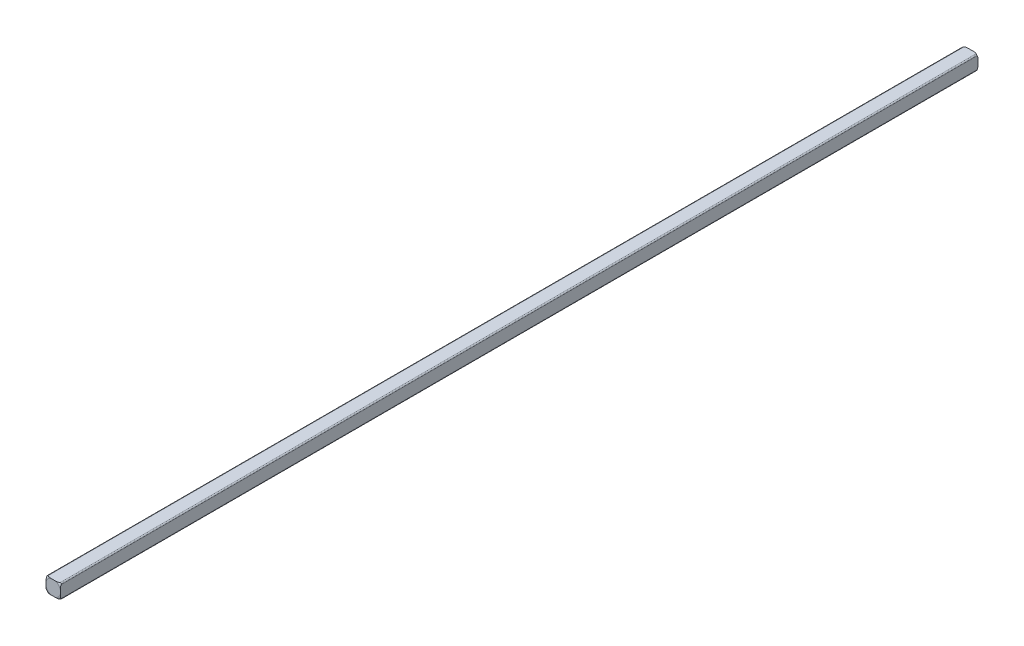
SolidWorks part; units mm, degrees
ref_plane "Front" through (0, 0, 0) normal (0, 0, 1) x (1, 0, 0)
ref_plane "Top" through (0, 0, 0) normal (0, 1, 0) x (1, 0, 0)
ref_plane "Right" through (0, 0, 0) normal (1, 0, 0) x (0, 0, -1)
imported_body "Imported3"
fillet "Fillet1" radius 0.254
sketch "Sketch1" plane through (0, 0, 0) normal (0, 1, 0) x (1, 0, 0)
  line L1 (6.21, -152.4) -> (-13.2647, -152.4)
  line L2 (6.21, -152.4) -> (6.21, -50.8)
  line L3 (6.21, -50.8) -> (-13.2647, -50.8)
  line L4 (-13.2647, -152.4) -> (-13.2647, -50.8)
  line L5 (-13.2647, -50.8) -> (13.7616, -50.8)
  line L6 (-13.2647, -50.8) -> (-13.2647, 221.1319)
  line L7 (-13.2647, 221.1319) -> (13.7616, 221.1319)
  line L8 (13.7616, -50.8) -> (13.7616, 221.1319)
  dimension "D1" = 101.6
extrude "Cut-Extrude1" cut sketch "Sketch1" against normal through all both and the other way through all contours L5 L8 L7 L6 L3
mirror "Mirror1" about plane through (0, -2.0879, 50.8) normal (0, 0, 1)
